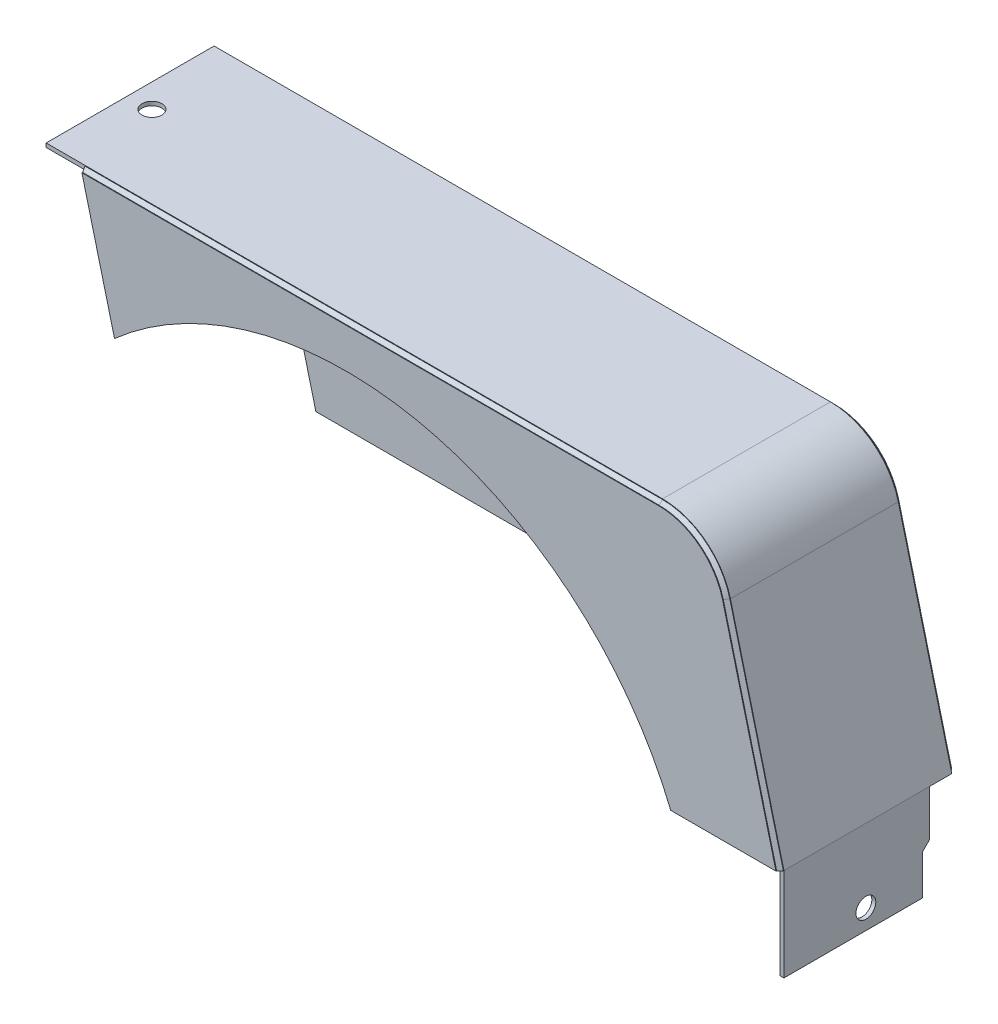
SolidWorks part; units mm, degrees
other "Objet de détail2"
other "Objet de détail3"
ref_plane "Face" through (0, 0, 0) normal (0, 0, 1) x (1, 0, 0)
ref_plane "Dessus" through (0, 0, 0) normal (0, 1, 0) x (1, 0, 0)
ref_plane "Droite" through (0, 0, 0) normal (1, 0, 0) x (0, 0, -1)
sketch "Esquisse1" plane through (0, 0, 0) normal (0, 0, 1) x (1, 0, 0)
  line L0 (-457.5928, 52.5378) -> (8.6102, 52.5378)
  line L1 (57.0434, 14.9566) -> (97.4072, -142.4622)
  line L2 (97.4072, -142.4622) -> (97.4072, -212.4622)
  line L3 (-457.5928, 55.5378) -> (8.6102, 55.5378)
  line L4 (59.9494, 15.7017) -> (100.4072, -142.0837)
  line L5 (100.4072, -142.0837) -> (100.4072, -212.4622)
  line L6 (97.4072, -212.4622) -> (100.4072, -212.4622)
  line L7 (-457.5928, 55.5378) -> (-457.5928, 52.5378)
  arc A0 (8.6102, 52.5378) -> (57.0434, 14.9566) centre (8.6102, 2.5378) cw
  arc A1 (8.6102, 55.5378) -> (59.9494, 15.7017) centre (8.6102, 2.5378) cw
  point P6 (47.4072, 52.5378)
  dimension "D5" = 50
  dimension "D1" = 555
  dimension "D2" = 195
  dimension "D3" = 70
  dimension "D4" = 50
  dimension "D6" = 3
extrude "Extrusion1" add sketch "Esquisse1" along normal blind 127
sketch "Esquisse3" plane through (0, 0, 127) normal (0, 0, 1) x (1, 0, 0)
  line L0 (57.0434, 14.9566) -> (97.4072, -142.4622) construction
  line L1 (-457.5928, 52.5378) -> (8.6102, 52.5378) construction
  line L2 (57.0434, 14.9566) -> (97.4072, -142.4622)
  line L3 (-427.5928, 52.5378) -> (8.6102, 52.5378)
  line L4 (97.4072, -142.4622) -> (17.815, -142.4622)
  line L5 (-427.5928, 52.5378) -> (-402.9061, -43.7406)
  arc A0 (57.0434, 14.9566) -> (8.6102, 52.5378) centre (8.6102, 2.5378) ccw construction
  arc A1 (57.0434, 14.9566) -> (8.6102, 52.5378) centre (8.6102, 2.5378) ccw
  arc A2 (17.815, -142.4622) -> (-402.9061, -43.7406) centre (-227.5928, -242.4622) ccw
  dimension "D4" = 530
  dimension "D2" = 525
  dimension "D3" = 100
  dimension "D5" = 200
extrude "Extrusion2" add sketch "Esquisse3" along normal mid plane 6 separate body
sketch "Esquisse4" plane through (0, 0, 0) normal (0, 0, -1) x (-1, 0, 0)
  line L0 (-97.4072, -142.4622) -> (-57.0434, 14.9566) construction
  line L1 (-8.6102, 52.5378) -> (427.5928, 52.5378) construction
  line L2 (-97.4072, -142.4622) -> (-57.0434, 14.9566)
  line L3 (-8.6102, 52.5378) -> (427.5928, 52.5378)
  line L4 (427.5928, 52.5378) -> (377.5928, -142.4622)
  line L5 (427.5928, 52.5378) -> (402.9061, -43.7406) construction
  line L6 (-97.4072, -142.4622) -> (377.5928, -142.4622)
  arc A0 (-8.6102, 52.5378) -> (-57.0434, 14.9566) centre (-8.6102, 2.5378) ccw construction
  arc A1 (-8.6102, 52.5378) -> (-57.0434, 14.9566) centre (-8.6102, 2.5378) ccw
extrude "Extrusion3" add sketch "Esquisse4" along normal mid plane 6 separate body
other "Cordon de soudure d'angle2" parameters "D10"=6, "D11"=2.5, "D12"=0, "D13"=3, "D14"=0
other "Cordon de soudure d'angle3" parameters "D10"=6, "D11"=2.5, "D12"=0, "D13"=3, "D14"=0
sketch "Esquisse6" plane through (0, 55.5378, 0) normal (0, 1, 0) x (-1, 0, 0)
  line L0 (-8.6102, 127) -> (457.5928, 127) construction
  line L1 (457.5928, 127) -> (457.5928, 0) construction
  circle A0 centre (439.5928, 65) radius 7.5
  dimension "D1" = 15
  dimension "D3" = 18
  dimension "D2" = 62
extrude "Enlèv. mat.-Extru.1" cut sketch "Esquisse6" against normal blind 6
sketch "Esquisse7" plane through (100.4072, 0, 0) normal (1, 0, 0) x (0, 0, -1)
  line L0 (-17, -142.0837) -> (20.4345, -142.0837)
  line L1 (-127, -142.0837) -> (0, -142.0837) construction
  line L2 (-17, -142.0837) -> (-17, -177.0837)
  line L3 (-17, -177.0837) -> (-22, -182.0837)
  line L4 (-22, -182.0837) -> (-22, -219.6616)
  line L5 (-22, -219.6616) -> (31.6026, -219.6616)
  line L6 (20.4345, -142.0837) -> (31.6026, -219.6616)
  line L7 (0, -212.4622) -> (0, -142.0837) construction
  line L8 (-127, -212.4622) -> (0, -212.4622) construction
  line L9 (-127, -212.4622) -> (-127, -142.0837) construction
  circle A0 centre (-65, -197.4622) radius 7.5
  dimension "D5" = 15
  dimension "D6" = 15
  dimension "D7" = 62
  dimension "D1" = 17
  dimension "D2" = 35
  dimension "D3" = 22
  dimension "D4" = 135
extrude "Enlèv. mat.-Extru.2" cut sketch "Esquisse7" against normal blind 3
